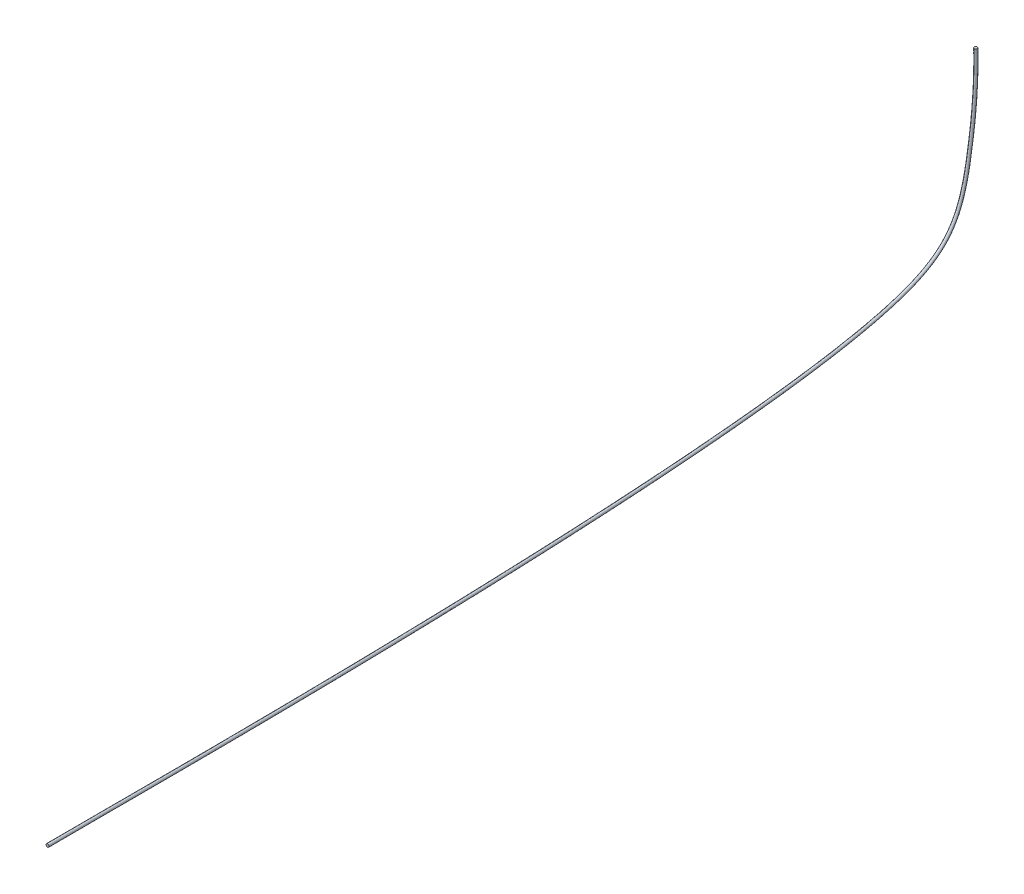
SolidWorks part; units mm, degrees
ref_plane "Front Plane" through (0, 0, 0) normal (0, 0, 1) x (1, 0, 0)
ref_plane "Top Plane" through (0, 0, 0) normal (0, 1, 0) x (1, 0, 0)
ref_plane "Right Plane" through (0, 0, 0) normal (1, 0, 0) x (0, 0, -1)
sketch "Sketch1" plane through (0, 0, 0) normal (0, 1, 0) x (1, 0, 0)
  circle A0 centre (0, 0) radius 19.05
  dimension "D1" = 38.1
sketch "Sketch2" plane through (0, 0, 0) normal (1, 0, 0) x (0, 0, -1)
  spline S0 degree 3 poles (0, 0) (8.4084, -405.2751) (-121.8578, -1637.4479) (-724.0737, -3009.0078) (-11101.9542, -2862.7164) (-11794.5862, -2880.36) knots 0 0 0 0 0.077458 0.301361 1 1 1 1
  dimension "D1" = 12141.2
  dimension "D2" = 2880.36
sweep "Sweep1" add profiles "Sketch1" path "Sketch2"
